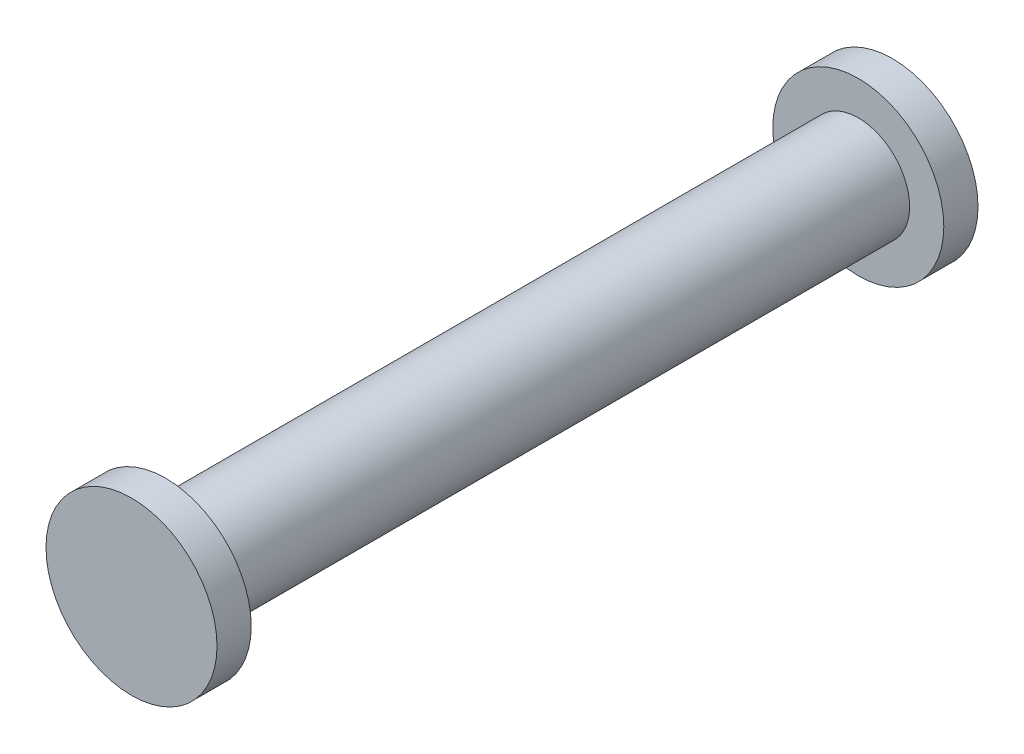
SolidWorks part; units mm, degrees
ref_plane "前视基准面" through (0, 0, 0) normal (0, 0, 1) x (1, 0, 0)
ref_plane "上视基准面" through (0, 0, 0) normal (0, 1, 0) x (1, 0, 0)
ref_plane "右视基准面" through (0, 0, 0) normal (1, 0, 0) x (0, 0, -1)
other "Configuration Table"
sketch "草图1" plane through (0, 0, 0) normal (0, 0, 1) x (1, 0, 0)
  circle A0 centre (0, 0) radius 5
  dimension "D1" = 10
extrude "Retained_Pin_D6" add sketch "草图1" against normal mid plane 44.5
sketch "草图2" plane through (0, 0, 0) normal (0, 0, 1) x (1, 0, 0)
  circle A0 centre (0, 0) radius 5.1
  circle A1 centre (0, 0) radius 3
  dimension "D1" = 6
  dimension "D2" = 10.2
extrude "Shaft_D6_EndCaps_D10" cut sketch "草图2" against normal mid plane 40.5
